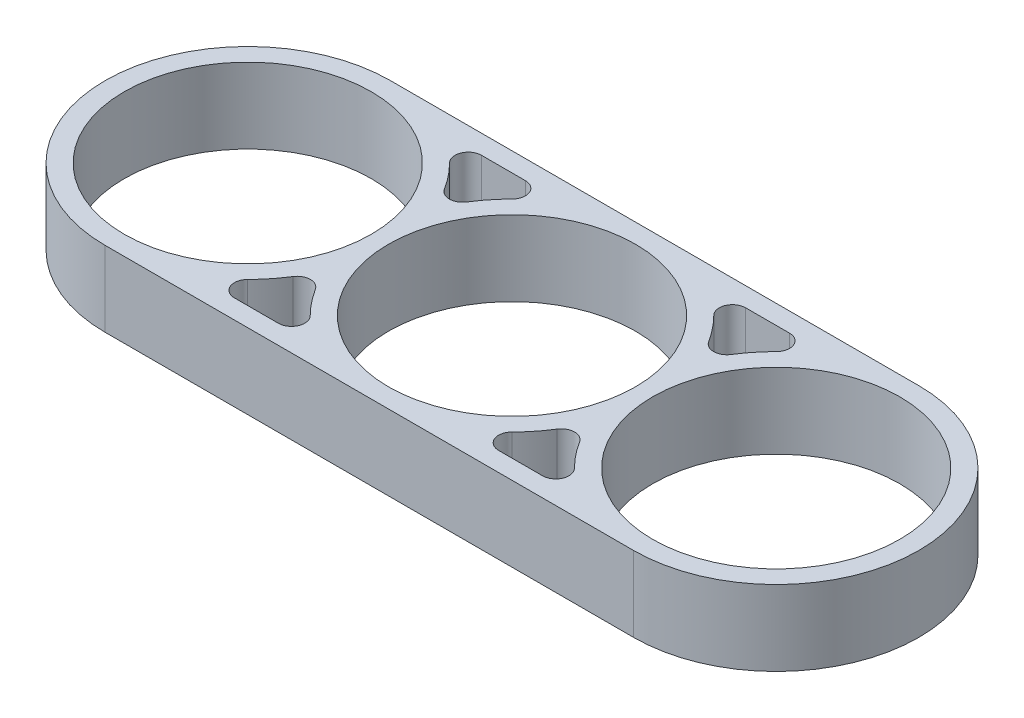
SolidWorks part; units mm, degrees
ref_plane "Ebene vorne" through (0, 0, 0) normal (0, 0, 1) x (1, 0, 0)
ref_plane "Ebene oben" through (0, 0, 0) normal (0, 1, 0) x (1, 0, 0)
ref_plane "Ebene rechts" through (0, 0, 0) normal (1, 0, 0) x (0, 0, -1)
sketch "Skizze1" plane through (0, 0, 0) normal (0, 1, 0) x (1, 0, 0)
  line L0 (-50, 0) -> (50, 0) construction
  line L1 (0, -50) -> (0, 50) construction
  line L2 (-20, 10.8) -> (20, 10.8)
  line L3 (-20, -10.8) -> (20, -10.8)
  line L4 (-11.6623, 9.35) -> (-8.3377, 9.35)
  line L5 (-11.6623, -9.35) -> (-8.3377, -9.35)
  line L6 (8.3377, -9.35) -> (11.6623, -9.35)
  line L7 (8.3377, 9.35) -> (11.6623, 9.35)
  circle A0 centre (-20, 0) radius 9.35
  circle A1 centre (0, 0) radius 9.35
  circle A2 centre (20, 0) radius 9.35
  arc A4 (9.1525, 5.7333) -> (7.6311, 7.6424) centre (0, 0) ccw
  arc A5 (10.8475, -5.7333) -> (12.3689, -7.6424) centre (20, 0) ccw
  arc A6 (-9.1525, -5.7333) -> (-7.6311, -7.6424) centre (0, 0) ccw
  arc A7 (-12.3689, -7.6424) -> (-10.8475, -5.7333) centre (-20, 0) ccw
  arc A8 (-10.8475, 5.7333) -> (-12.3689, 7.6424) centre (-20, 0) ccw
  arc A9 (7.6311, -7.6424) -> (9.1525, -5.7333) centre (0, 0) ccw
  arc A10 (20, -10.8) -> (20, 10.8) centre (20, 0) ccw
  arc A11 (-7.6311, 7.6424) -> (-9.1525, 5.7333) centre (0, 0) ccw
  arc A12 (-20, 10.8) -> (-20, -10.8) centre (-20, 0) ccw
  arc A13 (12.3689, 7.6424) -> (10.8475, 5.7333) centre (20, 0) ccw
  arc A14 (11.6623, -9.35) -> (12.3689, -7.6424) centre (11.6623, -8.35) ccw
  arc A15 (8.3377, -9.35) -> (7.6311, -7.6424) centre (8.3377, -8.35) cw
  arc A16 (-8.3377, -9.35) -> (-7.6311, -7.6424) centre (-8.3377, -8.35) ccw
  arc A17 (-11.6623, -9.35) -> (-12.3689, -7.6424) centre (-11.6623, -8.35) cw
  arc A18 (-10.8475, -5.7333) -> (-9.1525, -5.7333) centre (-10, -6.2642) cw
  arc A19 (10.8475, -5.7333) -> (9.1525, -5.7333) centre (10, -6.2642) ccw
  arc A20 (10.8475, 5.7333) -> (9.1525, 5.7333) centre (10, 6.2642) cw
  arc A21 (12.3689, 7.6424) -> (11.6623, 9.35) centre (11.6623, 8.35) ccw
  arc A22 (7.6311, 7.6424) -> (8.3377, 9.35) centre (8.3377, 8.35) cw
  arc A23 (-9.1525, 5.7333) -> (-10.8475, 5.7333) centre (-10, 6.2642) cw
  arc A24 (-7.6311, 7.6424) -> (-8.3377, 9.35) centre (-8.3377, 8.35) ccw
  arc A25 (-11.6623, 9.35) -> (-12.3689, 7.6424) centre (-11.6623, 8.35) ccw
  point P35 (-14.5947, -9.35)
  point P46 (5.4053, 9.35)
  dimension "D1" = 1
  dimension "D2" = 18.7
  dimension "D5" = 10.8
  dimension "D6" = 10.8
  dimension "D3" = 20
  dimension "D4" = 20
extrude "Aufsatz-Linear austragen1" add sketch "Skizze1" along normal blind 5.7
